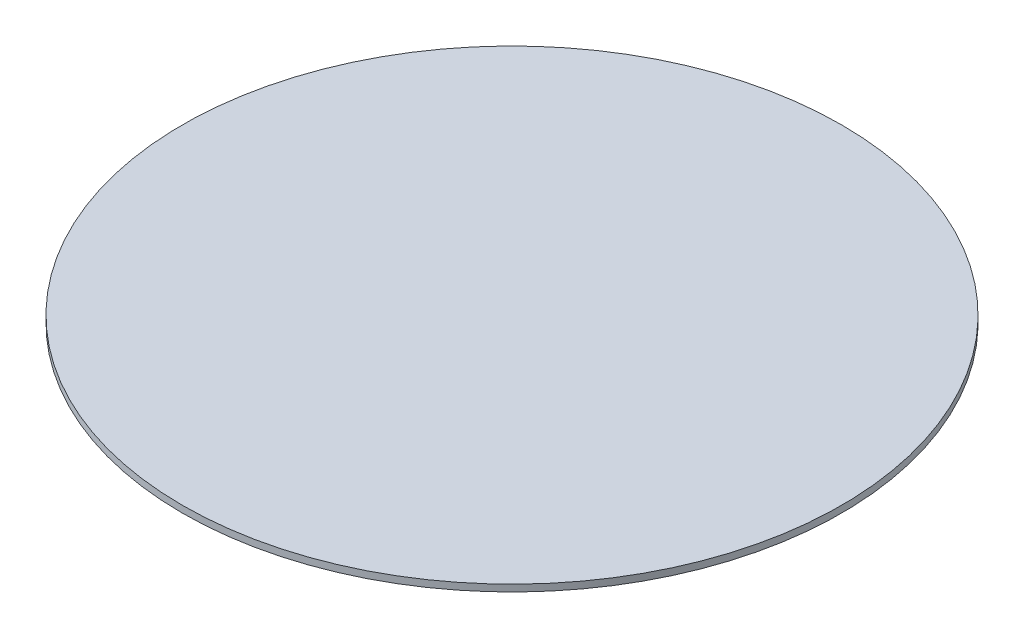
SolidWorks part; units mm, degrees
ref_plane "Alzado" through (0, 0, 0) normal (0, 0, 1) x (1, 0, 0)
ref_plane "Planta" through (0, 0, 0) normal (0, 1, 0) x (1, 0, 0)
ref_plane "Vista lateral" through (0, 0, 0) normal (1, 0, 0) x (0, 0, -1)
sketch "Croquis4" plane through (0, 0, 0) normal (0, 1, 0) x (1, 0, 0)
  circle A0 centre (0, 0) radius 97
  dimension "D1" = 194
extrude "Saliente-Extruir1" add sketch "Croquis4" along normal blind 2
